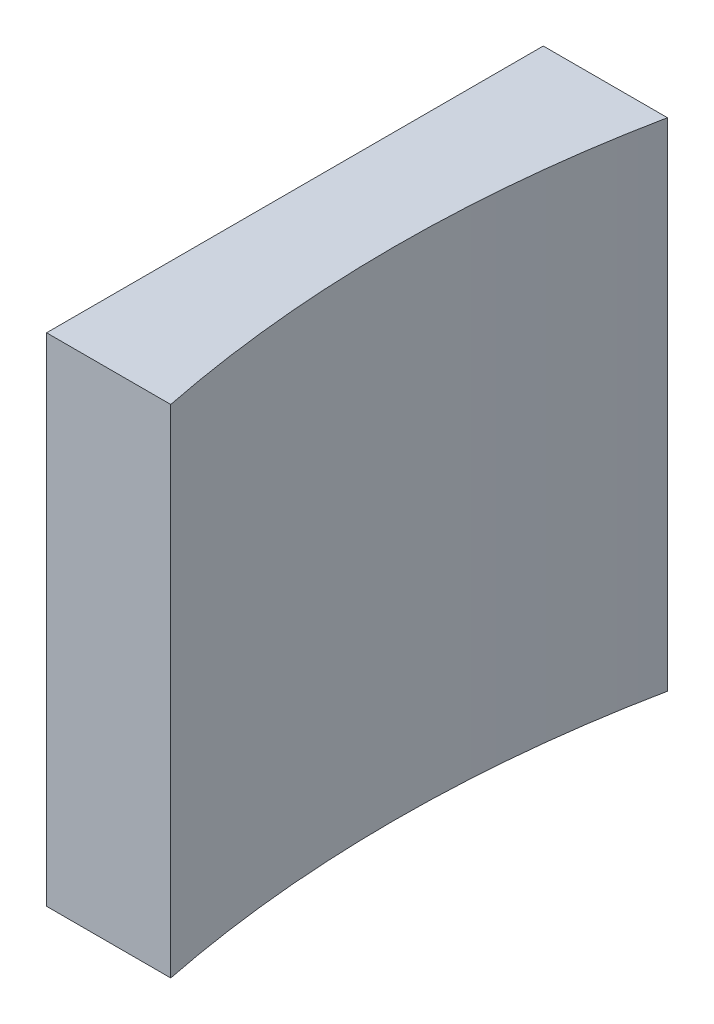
SolidWorks part; units mm, degrees
ref_plane "Vorne" through (0, 0, 0) normal (0, 0, 1) x (1, 0, 0)
ref_plane "Oben" through (0, 0, 0) normal (0, 1, 0) x (1, 0, 0)
ref_plane "Rechts" through (0, 0, 0) normal (1, 0, 0) x (0, 0, -1)
sketch "Skizze1" plane through (0, 0, 0) normal (0, 1, 0) x (1, 0, 0)
  line L0 (-50, 100) -> (-50, -100)
  line L1 (-50, 100) -> (0, 100)
  line L2 (-50, -100) -> (0, -100)
  arc A0 (0, 100) -> (0, -100) centre (495, 0) ccw
  point P1 (-50, 0)
  dimension "D1" = 200
  dimension "D2" = 50
  dimension "D3" = 10
extrude "Linear austragen1" add sketch "Skizze1" along normal blind 200
